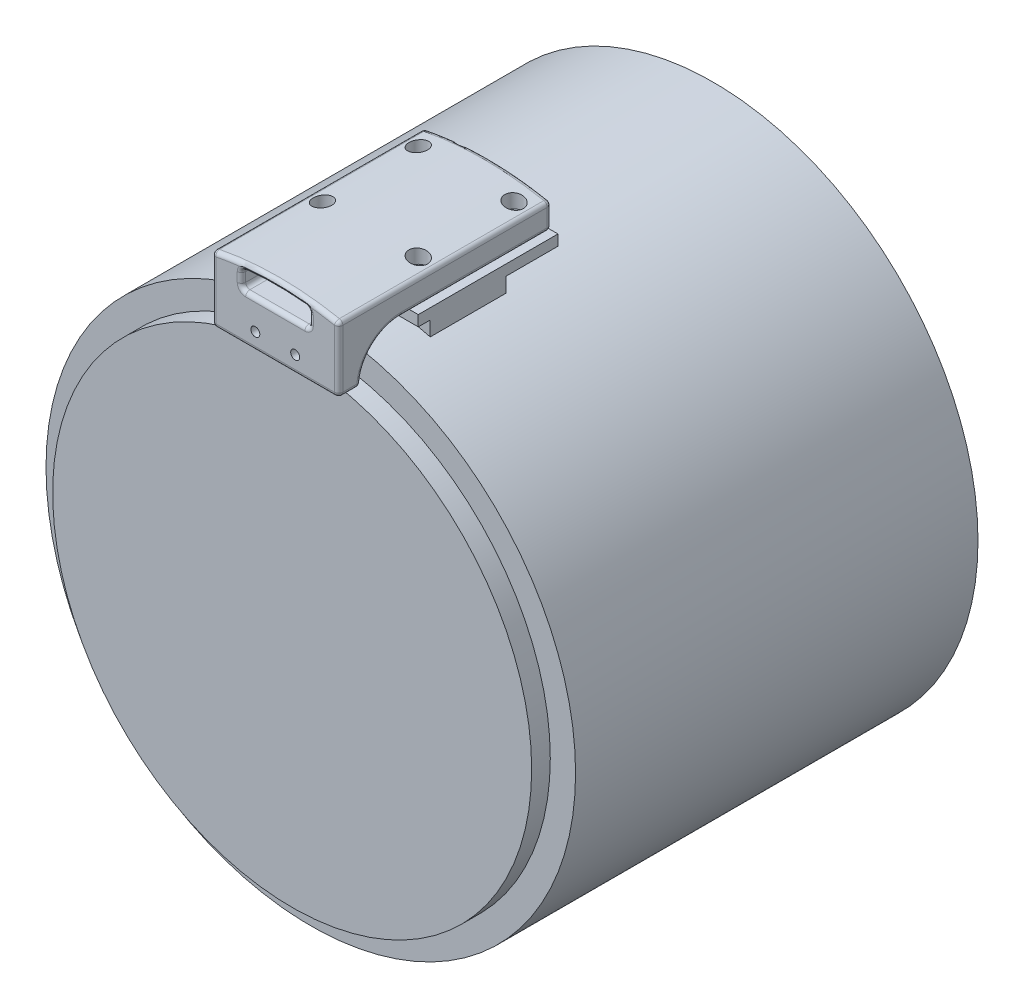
SolidWorks part; units mm, degrees
ref_plane "Front" through (0, 0, 0) normal (0, 0, 1) x (1, 0, 0)
ref_plane "Top" through (0, 0, 0) normal (0, 1, 0) x (1, 0, 0)
ref_plane "Right" through (0, 0, 0) normal (1, 0, 0) x (0, 0, -1)
sketch "Sketch6" plane through (0, 0, 0) normal (1, 0, 0) x (0, 0, -1)
  line L0 (-52.5, 0) -> (52.5, 0)
  line L1 (-52.5, 0) -> (-52.5, -8)
  line L2 (-80.7501, -12) -> (-43.5, -12) construction
  line L3 (52.5, -8) -> (52.5, 0)
  line L4 (220.8211, -211) -> (50220.8211, -211) construction
  line L5 (-94.7501, -31) -> (-80.7501, -31)
  line L6 (-94.7501, -31) -> (-94.7501, -211)
  line L10 (-80.7501, -12) -> (-80.7501, -31)
  line L13 (-80.7501, -12) -> (-43.5, -12)
  line L16 (221.6818, -12) -> (221.6818, -211)
  line L19 (-52.5, -8) -> (-43.5, -8)
  line L20 (-43.5, -8) -> (-43.5, -12)
  line L21 (52.5, -8) -> (13.4999, -8)
  line L22 (13.4999, -8) -> (13.4999, -12)
  line L23 (-43.5, -12) -> (-43.5, -20.034)
  line L24 (13.4999, -12) -> (221.6818, -12)
  line L25 (-43.5, -20.034) -> (13.4999, -20.034)
  line L26 (13.4999, -20.034) -> (13.4999, -12)
  line L27 (-43.5, -12) -> (13.4999, -12)
  line L28 (-94.7501, -211) -> (221.6818, -211)
  line L29 (-97.0702, -4.03) -> (35258.2689, -35359.369) construction
  point P4 (0, 0)
  point P13 (-101.1001, 0)
other "AlignGroup1" parameters "D1"=106.9155, "D2"=105, "D3"=357.0846, "D4"=14, "D5"=42.2501, "D6"=19.4177, "D7"=3.0566, "D8"=17.0676, "D9"=361.7839, "D10"=4, "D11"=53.418, "D12"=6.4492
revolve "Revolve2" add sketch "Sketch6" angle 360 about L4
extrude "Boss-Extrude2" add sketch "Sketch6<5>" along normal mid plane 105
sketch "Sketch6<5>"
sketch "Sketch2" plane through (0, 0, 0) normal (0, 0, 1) x (1, 0, 0)
  line L0 (-47.625, 0) -> (47.625, 0)
  line L1 (47.625, 0) -> (47.625, 19.0725)
  line L2 (0, 0) -> (0, 169234.1751) construction
  line L3 (-47.625, 0) -> (-47.625, 19.0725)
  arc A0 (-47.625, 19.0725) -> (47.625, 19.0725) centre (0, -211) cw
  dimension "D1" = 234.95
  dimension "D2" = 211
  dimension "D3" = 95.25
extrude "Boss-Extrude1" add sketch "Sketch2" along normal mid plane 105 separate body
ref_plane "Plane1" through (0, 23.95, 0) normal (0, 1, 0) x (1, 0, 0)
hole_wizard "CBORE for M5 SHCS1" positions "Sketch3" profile "Sketch4" counterbore size "M5" standard "ANSI Metric"
sketch "Sketch3" plane through (0, 23.95, 0) normal (0, 1, 0) x (1, 0, 0)
  line L0 (0, 0) -> (0, 50000) construction
  line L1 (0, 0) -> (50000, 0) construction
  line L2 (-36, 36) -> (-36, -36) construction
  line L3 (-36, -36) -> (36, -36) construction
  point P0 (-36, 36)
  point P8 (-36, -36)
  point P9 (36, -36)
  point P10 (36, 36)
  dimension "D1" = 72
sketch "Sketch4" plane through (-36, 23.95, -36) normal (1, 0, 0) x (0, 0, 1)
  line L0 (0, 0) -> (0, 433.95)
  line L1 (0, 433.95) -> (2.875, 433.95)
  line L3 (2.875, 433.95) -> (2.875, 12.62)
  line L4 (2.875, 12.62) -> (7, 12.62)
  line L5 (7, 12.62) -> (7, 0)
  line L7 (7, 0) -> (0, 0)
  line L11 (0, -6.35) -> (0, 107.95) construction
  dimension "Thru Hole Dia." = 5.75
  dimension "Thru Hole Depth" = 433.95
  dimension "C'Bore Dia." = 14
  dimension "C'Bore Depth" = 12.62
shell "Shell1" [suppressed] thickness 3.175
sketch "Sketch7" plane through (0, 0, 52.5) normal (0, 0, 1) x (1, 0, 0)
  line L3 (-47.625, 19.0725) -> (-47.625, 0)
  line L4 (-47.625, 0) -> (47.625, 0)
  line L5 (47.625, 0) -> (47.625, 19.0725)
  line L6 (-47.625, 19.0725) -> (-47.625, 0)
  line L7 (-47.625, 0) -> (47.625, 0)
  line L8 (47.625, 0) -> (47.625, 19.0725)
  arc A1 (47.625, 19.0725) -> (-47.625, 19.0725) centre (0, -211) ccw
  arc A2 (47.625, 19.0725) -> (-47.625, 19.0725) centre (0, -211) ccw
  dimension "D1" = 0
ref_plane "Plane2" through (0, -50.5501, 50.5501) normal (0, -0.7071, 0.7071) x (0, -0.7071, -0.7071)
extrude "Boss-Extrude3" add sketch "Sketch7" along normal offset from surface (54.9501 mm away) 12.7
sketch "Sketch9" plane through (47.625, 0, 0) normal (1, 0, 0) x (0, 0, -1)
  line L0 (-107.4501, 0) -> (52.5, 0) construction
  line L2 (-107.4501, 0) -> (-60.5554, 0)
  line L3 (-90.7616, -30.2062) -> (-107.4501, -30.2062)
  line L5 (-94.7501, -31) -> (-80.7501, -31) construction
  line L6 (-107.4501, -30.2062) -> (-107.4501, 0)
  line L8 (-107.4501, 19.0725) -> (-107.4501, 0) construction
  line L9 (-80.7501, -12) -> (-82.9904, -9.9803) construction
  arc A0 (-60.5554, 0) -> (-90.7616, -30.2062) centre (-60.5554, -30.2062) ccw
  dimension "D1" = 0.7937
  dimension "D2" = 3.0162
extrude "Boss-Extrude4" add sketch "Sketch9" against normal up to surface (95.25 mm away)
sketch "Sketch17" plane through (0, 0, 107.4501) normal (0, 0, 1) x (1, 0, 0)
  line L0 (-47.625, 0) -> (47.625, 0) construction
  line L1 (-22.225, 4.7625) -> (22.225, 4.7625)
  line L2 (-25.4, 7.9375) -> (-25.4, 14.9219)
  line L4 (25.4, 7.9375) -> (25.4, 14.9219)
  line L5 (0, 0) -> (0, 4.7625) construction
  arc A0 (-22.5358, 18.0817) -> (22.5358, 18.0817) centre (0, -211) cw
  arc A1 (47.625, 19.0725) -> (-47.625, 19.0725) centre (0, -211) ccw construction
  arc A2 (22.225, 4.7625) -> (25.4, 7.9375) centre (22.225, 7.9375) ccw
  arc A3 (22.5358, 18.0817) -> (25.4, 14.9219) centre (22.225, 14.9219) cw
  arc A4 (-22.225, 4.7625) -> (-25.4, 7.9375) centre (-22.225, 7.9375) cw
  arc A5 (-25.4, 14.9219) -> (-22.5358, 18.0817) centre (-22.225, 14.9219) cw
  dimension "D2" = 4.7625
  dimension "D3" = 3.175
  dimension "D1" = 4.7625
  dimension "D4" = 50.8
extrude "Cut-Extrude4" cut sketch "Sketch17" against normal up to surface (159.9501 mm away)
sketch "Sketch12" plane through (0, 0, 0) normal (0, -1, 0) x (1, 0, 0)
  line L1 (19.05, -58.85) -> (-19.05, -58.85)
  line L2 (25.4, -52.5) -> (25.4, -7.425)
  line L3 (19.05, -1.075) -> (-19.05, -1.075)
  line L4 (-25.4, -52.5) -> (-25.4, -7.425)
  line L5 (0, -1.075) -> (0, -58.85) construction
  line L6 (25.4, -29.9625) -> (-25.4, -29.9625) construction
  line L7 (25.4, -58.85) -> (36, -36) construction
  line L9 (-47.625, -52.5) -> (47.625, -52.5) construction
  arc A1 (-19.05, -1.075) -> (-25.4, -7.425) centre (-19.05, -7.425) ccw
  arc A2 (-19.05, -58.85) -> (-25.4, -52.5) centre (-19.05, -52.5) cw
  arc A3 (19.05, -58.85) -> (25.4, -52.5) centre (19.05, -52.5) ccw
  arc A4 (25.4, -7.425) -> (19.05, -1.075) centre (19.05, -7.425) ccw
  circle A5 centre (-36, -36) radius 2.875 construction
  point P0 (0, -29.9625)
  point P11 (-25.4, -1.075)
  point P20 (25.4, -1.075)
  point P26 (0, -52.5)
  dimension "D1" = 50.8
  dimension "D3" = 6.35
  dimension "D2" = 34.925
extrude "Cut-Extrude3" cut sketch "Sketch12" against normal blind 10
sketch "Sketch16" plane through (0, 0, 107.4501) normal (0, 0, 1) x (1, 0, 0)
  line L1 (-47.625, -30.2062) -> (47.625, -30.2062)
  line L2 (-47.625, -30.2062) -> (-47.625, -4.8062)
  line L3 (-47.625, -4.8062) -> (47.625, -4.8062)
  line L4 (47.625, -30.2062) -> (47.625, -4.8062)
  line L5 (47.625, 19.0725) -> (47.625, -30.2062) construction
  dimension "D1" = 25.4
fillet "Fillet1" radius 3.175 41 edges at (24.5745, 5.802, -4.2941) (20.6935, 4.7625, -1.2914) (-24.5745, 5.802, -4.2941) (-20.6935, 4.7625, -1.2914) (0, 4.7625, -1.075) (25.4, 0, -29.9625) (23.5401, 0, -2.9349) (0, 0, -1.075) (-23.5401, 0, -2.9349) (-47.625, 0, 4.0277) (47.625, 0, 4.0277) (-25.4, 7.461, -52.5) (-24.5774, 17.0543, -52.5) (0, 19.1875, -52.5) (24.5774, 17.0543, -52.5) (0, 23.95, -52.5) (0, 23.95, 107.4501) (47.625, -5.5669, 107.4501) (0, -30.2062, 107.4501) (-47.625, -5.5669, 107.4501) (0, 19.1875, 107.4501) (-24.5774, 17.0543, 107.4501) (-25.4, 11.4297, 107.4501) (-24.4701, 5.6924, 107.4501) (0, 4.7625, 107.4501) (24.4701, 5.6924, 107.4501) (25.4, 11.4297, 107.4501) (24.5774, 17.0543, 107.4501) (-47.625, 9.5363, -52.5) (36.5125, 0, -52.5) (-36.5125, 0, -52.5) (-25.4, 0, -29.9625) (0, -30.2062, 90.7616) (-47.625, -8.8472, 81.9144) (47.625, -8.8472, 81.9144) (-47.625, -30.2062, 99.1059) (47.625, -30.2062, 99.1059) (47.625, 19.0725, 27.4751) (-47.625, 19.0725, 27.4751) (47.625, 9.5363, -52.5) (25.4, 7.461, -52.5)
sketch "Sketch18" plane through (0, -30.2062, 0) normal (0, -1, 0) x (1, 0, 0)
  line L0 (-47.625, 107.4501) -> (47.625, 107.4501) construction
  line L1 (-31.75, 97.9251) -> (31.75, 97.9251)
  line L2 (-31.75, 97.9251) -> (-31.75, 60.5554)
  line L3 (-31.75, 60.5554) -> (31.75, 60.5554)
  line L4 (31.75, 97.9251) -> (31.75, 60.5554)
  line L5 (0, 107.4501) -> (0, 97.9251) construction
  line L6 (-47.625, 107.4501) -> (47.625, 107.4501) construction
  line L7 (-44.45, 60.5554) -> (44.45, 60.5554) construction
  dimension "D1" = 9.525
  dimension "D2" = 63.5
extrude "Cut-Extrude5" cut sketch "Sketch18" against normal up to surface (30.2062 mm away)
fillet "Fillet2" radius 3.175 12 edges at (31.75, -30.2062, 95.8552) (0, -30.2062, 97.9251) (-31.75, -30.2062, 95.8552) (31.75, -7.8545, 80.8733) (-31.75, -7.8545, 80.8733) (31.75, 0, 79.2402) (31.75, -15.1031, 97.9251) (0, 0, 97.9251) (-31.75, -15.1031, 97.9251) (-31.75, 0, 79.2402) (31.75, -29.3807, 91.6497) (-31.75, -29.3807, 91.6497)
hole_wizard "1/4 Clearance Hole1" positions "Sketch20" profile "Sketch21" hole size "1/4" standard "ANSI Inch"
sketch "Sketch20" plane through (0, 0, 107.4501) normal (0, 0, 1) x (1, 0, 0)
  line L0 (-14.986, -17.4625) -> (14.986, -17.4625) construction
  line L2 (0, 0) -> (0, -17.4625) construction
  line L4 (-22.225, 4.7625) -> (22.225, 4.7625) construction
  point P0 (-14.986, -17.4625)
  point P2 (14.986, -17.4625)
  dimension "D1" = 29.972
  dimension "D2" = 22.225
sketch "Sketch21" plane through (-14.986, -17.4625, 107.4501) normal (1, 0, 0) x (0, -1, 0)
  line L0 (0, 0) -> (0, 329.1319)
  line L1 (0, 329.1319) -> (3.3782, 329.1319)
  line L2 (3.3782, 329.1319) -> (3.3782, 0)
  line L5 (3.3782, 0) -> (0, 0)
  line L11 (0, -6.35) -> (0, 107.95) construction
  dimension "Thru Hole Dia." = 6.7564
  dimension "Thru Hole Depth" = 329.1319
